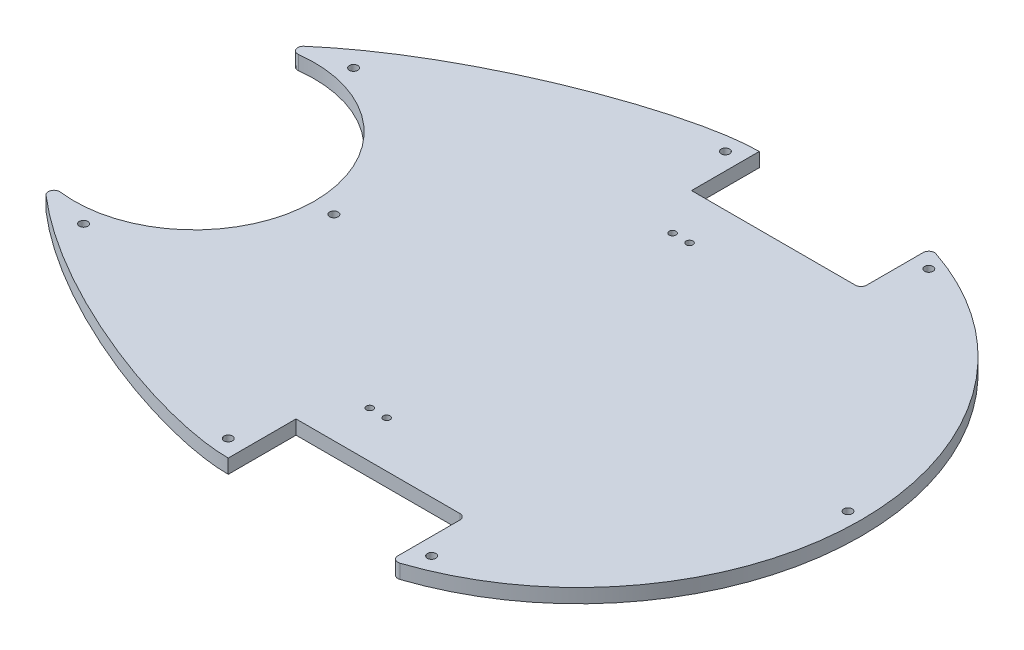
SolidWorks part; units mm, degrees
ref_plane "Front Plane" through (0, 0, 0) normal (0, 0, 1) x (1, 0, 0)
ref_plane "Top Plane" through (0, 0, 0) normal (0, 1, 0) x (1, 0, 0)
ref_plane "Right Plane" through (0, 0, 0) normal (1, 0, 0) x (0, 0, -1)
sketch "Sketch1" plane through (0, 0, 0) normal (0, 1, 0) x (1, 0, 0)
  line L0 (113.636, 127.2549) -> (113.636, 101.8549)
  line L1 (37.436, 129.7949) -> (-26.064, 129.7949) construction
  line L2 (-139.094, 40.9359) -> (-139.094, -22.5641) construction
  line L3 (37.436, -78.4851) -> (111.096, -78.4851)
  line L4 (37.436, 99.3149) -> (37.436, 129.7949)
  line L5 (113.636, -81.0251) -> (113.636, -108.8831)
  line L6 (-26.064, 129.7949) -> (-212.754, 40.8949) construction
  line L7 (37.436, -78.4851) -> (37.436, -108.9651)
  line L8 (-212.754, 40.8949) -> (-212.754, -20.0651) construction
  line L9 (37.436, 99.3149) -> (111.096, 99.3149)
  line L10 (-212.754, -20.0651) -> (-26.064, -108.9651) construction
  line L11 (-26.064, -108.9651) -> (37.436, -108.9651) construction
  arc A0 (116.9795, -111.2927) -> (116.9795, 129.6645) centre (76.806, 9.1859) ccw
  arc A1 (113.636, 127.2549) -> (116.9795, 129.6645) centre (116.176, 127.2549) cw
  arc A2 (113.636, -108.8831) -> (116.9795, -111.2927) centre (116.176, -108.8831) ccw
  arc A3 (111.096, -78.4851) -> (113.636, -81.0251) centre (111.096, -81.0251) cw
  arc A4 (111.096, 99.3149) -> (113.636, 101.8549) centre (111.096, 101.8549) ccw
  spline_without_curve S0
  point P16 (114.5137, 87.4439)
  dimension "D3" = 254
  dimension "D6" = 2.54
  dimension "D1" = 30.48
  dimension "D2" = 76.2
  dimension "D4" = 76.2
  dimension "D5" = 36.83
  dimension "D7" = 30.48
  dimension "D8" = 215.9
  dimension "D9" = 63.5
  dimension "D10" = 31.75
  dimension "D11" = 63.5
  dimension "D12" = 63.5
  dimension "D13" = 73.66
  dimension "D14" = 177.8
  dimension "D15" = 25.4
  dimension "D16" = 88.9
  dimension "D17" = 88.9
extrude "Boss-Extrude1" add sketch "Sketch1" along normal blind 6.35
sketch "Sketch2" plane through (0, 0, 0) normal (0, -1, 0) x (1, 0, 0)
  line L0 (111.096, -99.3149) -> (37.436, -99.3149) construction
  line L1 (37.436, -99.3149) -> (37.436, -129.7949) construction
  circle A0 centre (-97.184, -10.4149) radius 53.975
  dimension "D2" = 107.95
  dimension "D1" = 88.9
  dimension "D3" = 134.62
extrude "Cut-Extrude1" cut sketch "Sketch2" against normal through all
fillet "Fillet1" radius 2.54 2 edges at (-112.7345, 3.175, 41.2715) (-112.7345, 3.175, -62.1013)
sketch "Sketch3" plane through (0, 6.35, 0) normal (0, 1, 0) x (1, 0, 0)
  line L0 (37.436, -78.4851) -> (111.096, -78.4851) construction
  line L1 (111.096, 99.3149) -> (37.436, 99.3149) construction
  line L2 (37.436, 99.3149) -> (37.436, 129.7949) construction
  line L3 (113.636, 127.2549) -> (113.636, 101.8549) construction
  circle A0 centre (121.256, -101.3451) radius 1.905
  circle A1 centre (121.256, 122.1749) radius 1.905
  circle A2 centre (29.816, 122.1749) radius 1.905
  circle A3 centre (29.816, -101.3451) radius 1.905
  circle A4 centre (-86.2919, -50.2911) radius 1.905
  circle A5 centre (-86.2919, 71.1209) radius 1.905
  circle A6 centre (197.456, 9.6529) radius 1.905
  circle A7 centre (-33.684, 9.6529) radius 1.905
  dimension "D1" = 3.81
  dimension "D2" = 3.81
  dimension "D3" = 3.81
  dimension "D4" = 3.81
  dimension "D5" = 3.81
  dimension "D6" = 3.81
  dimension "D7" = 3.81
  dimension "D8" = 3.81
  dimension "D9" = 28.194
  dimension "D10" = 28.194
  dimension "D11" = 22.86
  dimension "D12" = 22.86
  dimension "D13" = 7.62
  dimension "D14" = 7.62
  dimension "D15" = 89.662
  dimension "D16" = 71.12
  dimension "D17" = 83.82
extrude "Cut-Extrude2" cut sketch "Sketch3" against normal through all
sketch "Sketch4" plane through (0, 0, 0) normal (0, -1, 0) x (-1, 0, 0)
  circle A0 centre (-57.375, -57.6571) radius 1.524
  circle A1 centre (-49.755, -57.6571) radius 1.524
  circle A2 centre (-49.755, 78.4869) radius 1.524
  circle A3 centre (-57.375, 78.4869) radius 1.524
extrude "Cut-Extrude3" cut sketch "Sketch4" against normal through all
